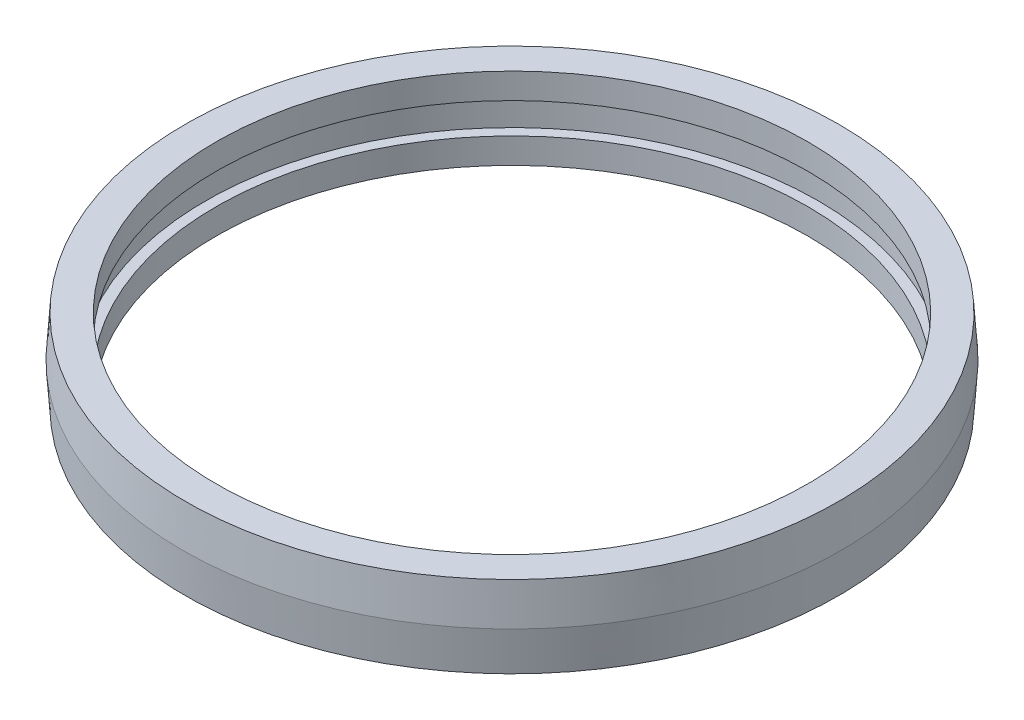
SolidWorks part; units mm, degrees
ref_plane "Front" through (0, 0, 0) normal (0, 0, 1) x (1, 0, 0)
ref_plane "Top" through (0, 0, 0) normal (0, 1, 0) x (1, 0, 0)
ref_plane "Right" through (0, 0, 0) normal (1, 0, 0) x (0, 0, -1)
sketch "Sketch3" plane through (0, 0, 0) normal (0, 0, 1) x (1, 0, 0)
  line L0 (0, 0) -> (0, 45.3916) construction
  line L2 (-102.4881, 0) -> (0, 0) construction
  line L18 (-92.075, -4.7625) -> (-95.25, -4.7625)
  line L19 (-95.25, -4.7625) -> (-95.25, 4.7625)
  line L20 (-95.25, 4.7625) -> (-92.075, 4.7625)
  line L21 (-92.075, 4.7625) -> (-92.075, 12.7)
  line L22 (-92.075, 12.7) -> (-101.6, 12.7)
  line L23 (-101.6, 12.7) -> (-102.4881, 0)
  line L24 (-102.4881, 0) -> (-101.6, -12.7)
  line L25 (-101.6, -12.7) -> (-92.075, -12.7)
  line L26 (-92.075, -12.7) -> (-92.075, -4.7625)
  dimension "D1" = 92.075
  dimension "D2" = 9.525
  dimension "D3" = 25.4
  dimension "D4" = 95.25
  dimension "D5" = 9.525
  dimension "D6" = 12.7
  dimension "D7" = 10.4131
  dimension "D8" = 7.9375
  dimension "D9" = 102.4881
  dimension "D10" = 3.175
revolve "Revolve1" add sketch "Sketch3" angle 360 about L0
